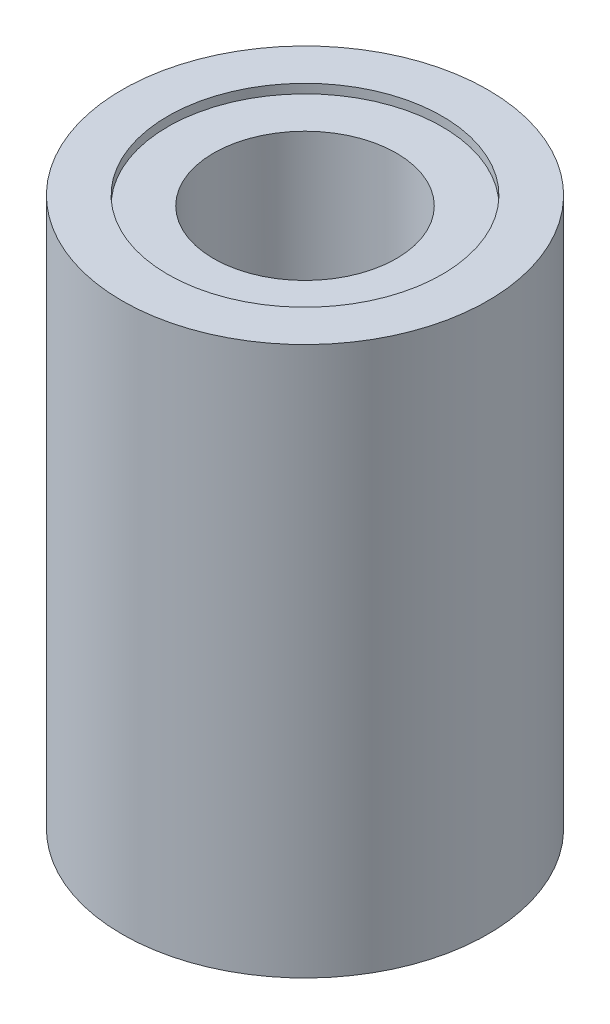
SolidWorks part; units mm, degrees
ref_plane "Piano frontale" through (0, 0, 0) normal (0, 0, 1) x (1, 0, 0)
ref_plane "Piano superiore" through (0, 0, 0) normal (0, 1, 0) x (1, 0, 0)
ref_plane "Piano destro" through (0, 0, 0) normal (1, 0, 0) x (0, 0, -1)
sketch "Schizzo1" plane through (0, 0, 0) normal (0, 1, 0) x (1, 0, 0)
  circle A0 centre (0, 0) radius 4
  circle A1 centre (0, 0) radius 2
  dimension "D1" = 8
  dimension "D2" = 4
extrude "Estrusione-Estrusione1" add sketch "Schizzo1" along normal blind 12
sketch "Schizzo2" plane through (0, 12, 0) normal (0, 1, 0) x (1, 0, 0)
  circle A0 centre (0, 0) radius 3
  circle A1 centre (0, 0) radius 2
  dimension "D1" = 6
  dimension "D2" = 4
extrude "Taglio-Estrusione1" cut sketch "Schizzo2" against normal blind 0.2
sketch "Schizzo3" plane through (0, 0, 0) normal (0, -1, 0) x (1, 0, 0)
  circle A0 centre (0, 0) radius 3
  circle A1 centre (0, 0) radius 2
  dimension "D1" = 6
  dimension "D2" = 4
extrude "Taglio-Estrusione2" cut sketch "Schizzo3" against normal blind 0.2
